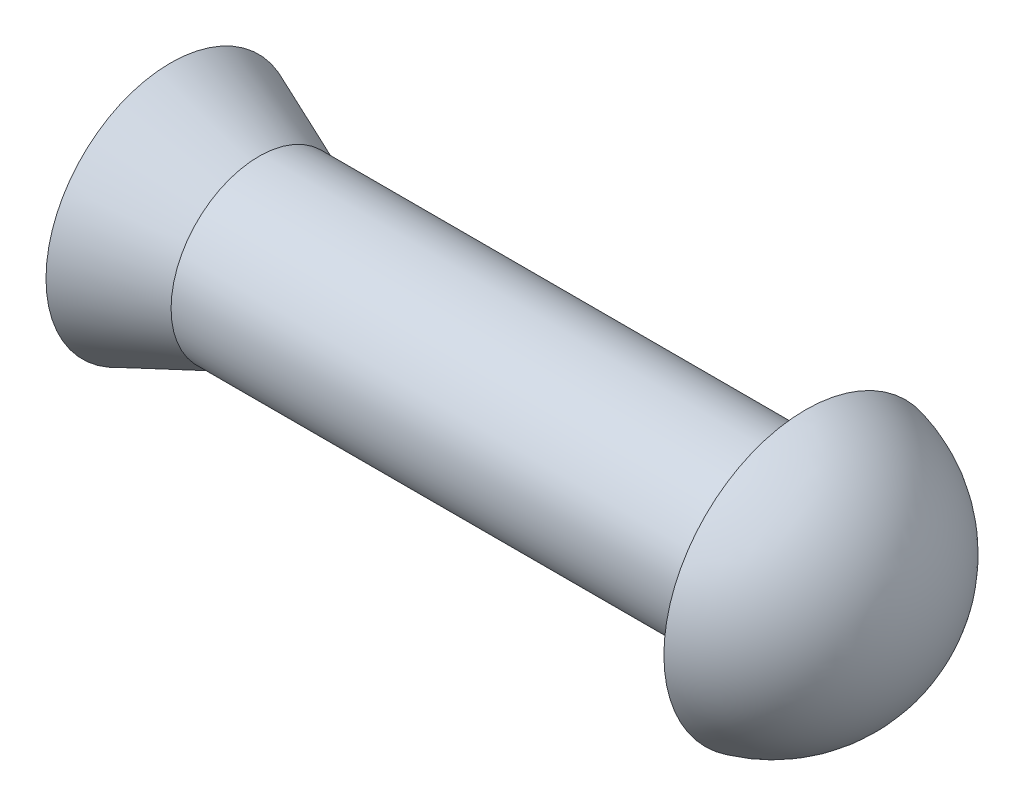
SolidWorks part; units mm, degrees
ref_plane "Plane1" through (0, 0, 0) normal (0, 0, 1) x (1, 0, 0)
ref_plane "Plane2" through (0, 0, 0) normal (0, 1, 0) x (1, 0, 0)
ref_plane "Plane3" through (0, 0, 0) normal (1, 0, 0) x (0, 0, -1)
sketch "Sketch1" plane through (0, 0, 0) normal (0, 0, 1) x (1, 0, 0)
  line L0 (-39, 0) -> (6, 0) construction
  line L1 (-131.9234, 0) -> (0, 0)
  line L2 (-111.8934, 18) -> (-130, 25.5)
  line L3 (-111.8934, 18) -> (0, 18)
  line L4 (0, 18) -> (0, 0)
  line L5 (-111.8934, -18) -> (-130, -25.5) construction
  arc A0 (-130, 25.5) -> (-131.9234, 0) centre (38.0766, 0) ccw
  point P12 (-111.8934, 18)
  dimension "HeadRadius" = 170
  dimension "Diameter" = 36
  dimension "GripLength" = 130
  dimension "HeadDia" = 51
  dimension "HeadAng" = 45
revolve "Base-Revolve" add sketch "Sketch1" angle 360 about L0
sketch "Sketch2" plane through (0, 0, 0) normal (0, 0, 1) x (1, 0, 0)
  line L0 (-49, 0) -> (29, 0) construction
  line L1 (0, 0) -> (23, 0)
  line L2 (0, 0) -> (0, 29)
  arc A0 (23, 0) -> (0, 29) centre (-6.7826, 0) ccw
  dimension "HeadDiaA" = 58
  dimension "HeadHtA" = 23
revolve "HeadTypeA" add sketch "Sketch2" angle 360 about L0
sketch "Sketch3" plane through (0, 0, 0) normal (0, 0, 1) x (1, 0, 0)
  line L0 (10, 0) -> (-136, 0) construction
  line L1 (-39, 0) -> (6, 0) construction
  line L2 (-19.3137, 0) -> (2, 0)
  line L3 (0, 26) -> (-19.3137, 18)
  line L5 (0, -26) -> (-19.3137, -18) construction
  line L6 (-19.3137, 0) -> (-19.3137, 18)
  arc A0 (2, 0) -> (0, 26) centre (-168, 0) ccw
  dimension "D1" = 170
  dimension "HeadDiaB" = 52
  dimension "D2" = 45
  dimension "D3" = 36
revolve "HeadTypeB" [suppressed] add sketch "Sketch3" angle 360 about L0
equation "\"D3@Sketch3\" = \"Diameter@Sketch1\""
equation "\"D2@Sketch3\" = \"HeadAng@Sketch1\""
equation "\"D1@Sketch3\" = \"HeadRadius@Sketch1\""
